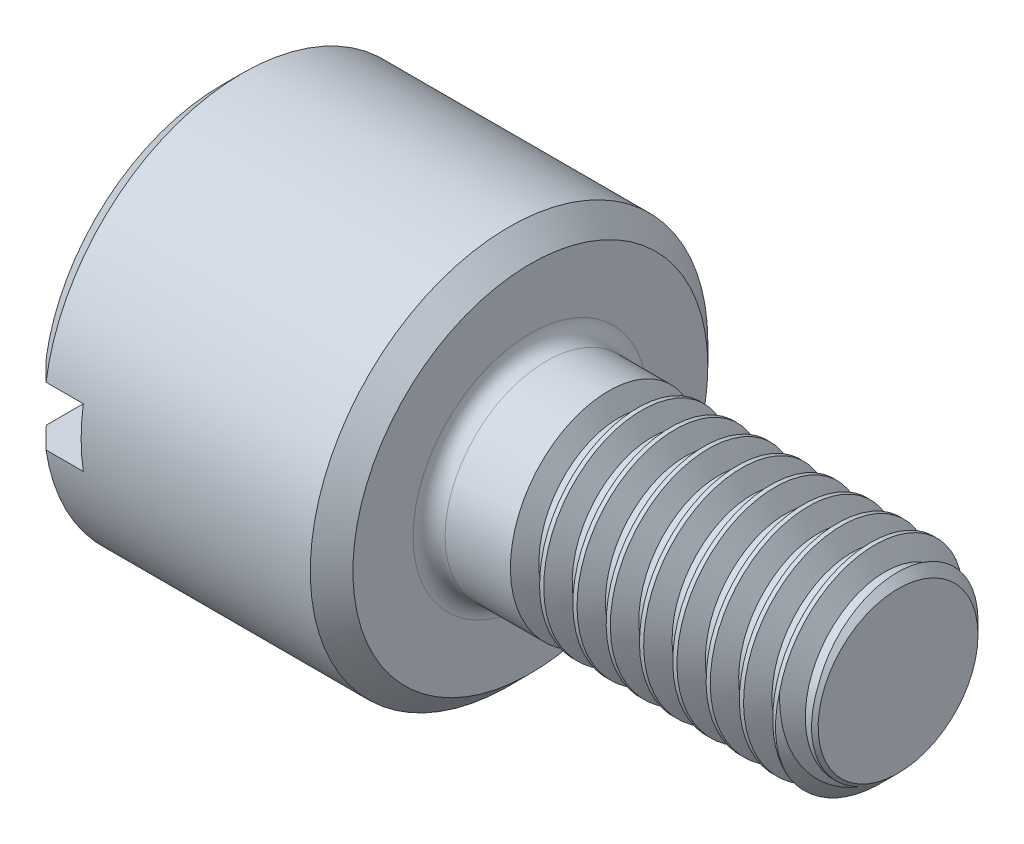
SolidWorks part; units mm, degrees
ref_plane "Front Plane" through (0, 0, 0) normal (0, 0, 1) x (1, 0, 0)
ref_plane "Top Plane" through (0, 0, 0) normal (0, 1, 0) x (1, 0, 0)
ref_plane "Right Plane" through (0, 0, 0) normal (1, 0, 0) x (0, 0, -1)
sketch "Sketch1" plane through (0, 0, 0) normal (0, 0, 1) x (1, 0, 0)
  line L0 (0, 11.6391) -> (0, 0) construction
  line L1 (0, 0) -> (18.4522, 0) construction
  line L2 (0, 0) -> (0, 4.2291)
  line L3 (0.508, 4.7371) -> (6.858, 4.7371)
  line L4 (7.366, 4.2291) -> (7.366, 2.794)
  line L5 (7.747, 2.413) -> (15.621, 2.413)
  line L6 (16.129, 1.905) -> (16.129, 0)
  line L7 (16.129, 0) -> (0, 0)
  line L8 (0, 4.2291) -> (0.508, 4.7371)
  line L9 (6.858, 4.7371) -> (7.366, 4.2291)
  line L10 (15.621, 2.413) -> (16.129, 1.905)
  arc A0 (7.366, 2.794) -> (7.747, 2.413) centre (7.747, 2.794) ccw
  point P5 (0, 4.7371)
  point P6 (7.366, 4.7371)
  point P8 (16.129, 2.413)
  dimension "D5" = 0.381
  dimension "D1" = 16.129
  dimension "D2" = 7.366
  dimension "D3" = 4.826
  dimension "D4" = 9.4742
revolve "Revolve1" add sketch "Sketch1" angle 360 about L7
thread "Thread1" pitch 0.7937 start angle 0, offset 1.524, length 7.62, pitch 0.7937, diameter 4.826
ref_plane "Plane1" through (17.145, 0, 2.413) normal (0, -1, 0) x (0, 0, 1)
sketch "Thread Profile1" plane through (17.145, 0, 2.413) normal (0, -1, 0) x (0, 0, 1)
  line L0 (0, 0) -> (0, 0.7937) construction
  line L11 (0, 0) -> (0, 0.6945)
  line L12 (0, 0.6945) -> (-0.4296, 0.4465)
  line L13 (-0.4296, 0.4465) -> (-0.4296, 0.248)
  line L15 (-0.4296, 0.248) -> (0, 0)
  line L17 (-0.4296, 0.3473) -> (0, 0.3473) construction
  point P2 (0, 0)
  dimension "Pitch" = 0.7937
  dimension "Profile_Angle" = 60
  dimension "Profile_Land" = 0.1984
  dimension "Profile_Height" = 0.4296
sketch "Sketch5" plane through (0, 0, 0) normal (0, 0, 1) x (1, 0, 0)
  line L1 (-1.397, -0.6985) -> (1.397, -0.6985)
  line L2 (-1.397, -0.6985) -> (-1.397, 0.6985)
  line L3 (-1.397, 0.6985) -> (1.397, 0.6985)
  line L4 (1.397, -0.6985) -> (1.397, 0.6985)
  line L5 (-1.397, -0.6985) -> (1.397, 0.6985) construction
  line L6 (-1.397, 0.6985) -> (1.397, -0.6985) construction
  point P0 (0, 0)
  dimension "D1" = 1.397
  dimension "D2" = 2.794
extrude "Cut-Extrude1" cut sketch "Sketch5" against normal through all both and the other way through all
sketch "Sketch6" plane through (0, 0, 0) normal (0, 0.809, -0.5878) x (1, 0, 0)
  line L4 (9.2765, 1.9834) -> (9.5245, 2.413)
  line L5 (9.5245, 2.413) -> (8.83, 2.413)
  line L6 (8.83, 2.413) -> (9.078, 1.9834)
  line L7 (9.078, 1.9834) -> (9.2765, 1.9834)
  line L8 (9.2765, 1.9834) -> (9.5245, 2.413)
  line L9 (9.5245, 2.413) -> (8.83, 2.413)
  line L10 (8.83, 2.413) -> (9.078, 1.9834)
  line L11 (9.078, 1.9834) -> (9.2765, 1.9834)
  dimension "D1" = 0
extrude "Cut-Extrude2" cut sketch "Sketch6" against normal up to surface (0 mm away)
